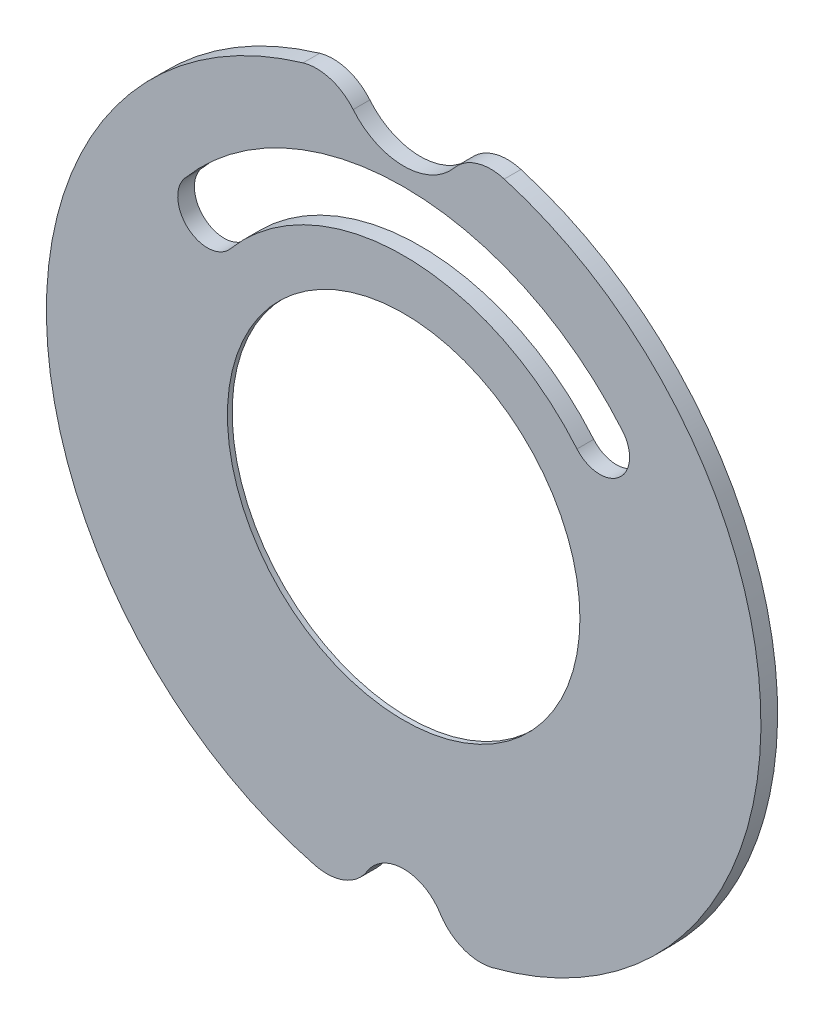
SolidWorks part; units mm, degrees
ref_plane "Plan de face" through (0, 0, 0) normal (0, 0, 1) x (1, 0, 0)
ref_plane "Plan de dessus" through (0, 0, 0) normal (0, 1, 0) x (1, 0, 0)
ref_plane "Plan de droite" through (0, 0, 0) normal (1, 0, 0) x (0, 0, -1)
sketch "Esquisse1" plane through (0, 0, 0) normal (0, 0, 1) x (1, 0, 0)
  line L0 (0, 0) -> (0, 157.2935) construction
  line L1 (0, 0) -> (154.0101, 129.2298) construction
  line L2 (0, 0) -> (-143.2239, 120.1791) construction
  circle A0 centre (0, 0) radius 150
  arc A1 (72.7742, 61.0648) -> (-72.7742, 61.0648) centre (0, 0) ccw
  arc A2 (91.9253, 77.1345) -> (-91.9253, 77.1345) centre (0, 0) ccw
  arc A3 (91.9253, 77.1345) -> (72.7742, 61.0648) centre (82.3498, 69.0997) cw
  arc A4 (-91.9253, 77.1345) -> (-72.7742, 61.0648) centre (-82.3498, 69.0997) ccw
  dimension "D1" = 300
  dimension "D2" = 240
  dimension "D3" = 190
  dimension "D4" = 50
extrude "Extrusion1" add sketch "Esquisse1" along normal blind 7
sketch "Esquisse2" plane through (-3.3041, -151.9743, 7) normal (0, 0, 1) x (1, 0, 0)
  line L0 (3.3041, 151.9743) -> (3.3041, 265.494) construction
  circle A0 centre (3.3041, 306.9743) radius 27.5
  dimension "D1" = 55
  dimension "D2" = 155
extrude "Enlèv. mat.-Extru.1" cut sketch "Esquisse2" against normal through all
fillet "Congé1" radius 20 2 edges at (26.4971, 147.6411, 3.5) (-26.4971, 147.6411, 3.5)
sketch "Esquisse3" plane through (163.7837, 72.5758, 7) normal (0, 0, 1) x (1, 0, 0)
  line L5 (-163.7837, -72.5758) -> (-366.2145, -72.5758) construction
  line L6 (-163.7837, -72.5758) -> (-163.7837, -166.0614) construction
  circle A5 centre (-163.7837, -218.5758) radius 18
  dimension "D7" = 36
  dimension "D6" = 146
extrude "Enlèv. mat.-Extru.2" cut sketch "Esquisse3" against normal through all
fillet "Congé2" radius 20 2 edges at (17.7574, -148.9452, 3.5) (-17.7574, -148.9452, 3.5)
shell "Coque1" thickness 2
sketch "Esquisse4" plane through (0, 0, 7) normal (0, 0, 1) x (1, 0, 0)
  circle A0 centre (0, 0) radius 74
  dimension "D1" = 148
extrude "Enlèv. mat.-Extru.3" cut sketch "Esquisse4" against normal through all
